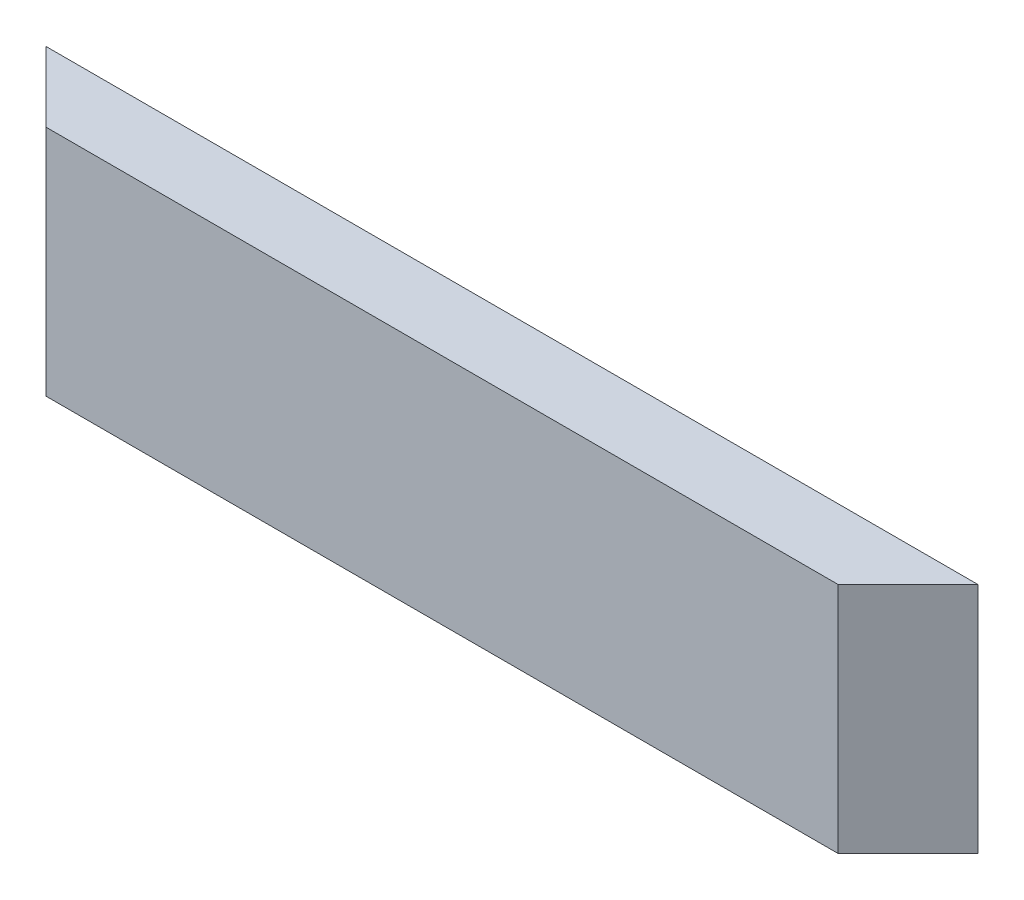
SolidWorks part; units mm, degrees
ref_plane "Ebene vorne" through (0, 0, 0) normal (0, 0, 1) x (1, 0, 0)
ref_plane "Ebene oben" through (0, 0, 0) normal (0, 1, 0) x (1, 0, 0)
ref_plane "Ebene rechts" through (0, 0, 0) normal (1, 0, 0) x (0, 0, -1)
sketch "Skizze1" plane through (0, 0, 0) normal (0, 0, 1) x (1, 0, 0)
  line L1 (-10, -2.5) -> (10, -2.5)
  line L2 (-10, -2.5) -> (-10, 2.5)
  line L3 (-10, 2.5) -> (10, 2.5)
  line L4 (10, -2.5) -> (10, 2.5)
  line L5 (-10, -2.5) -> (10, 2.5) construction
  line L6 (-10, 2.5) -> (10, -2.5) construction
  point P0 (0, 0)
  dimension "D1" = 20
  dimension "D2" = 5
extrude "Linear austragen1" add sketch "Skizze1" along normal blind 1.5
chamfer "Fase1" distance 1.5 angle 45 2 edges at (-10, 0, 1.5) (10, 0, 1.5)
